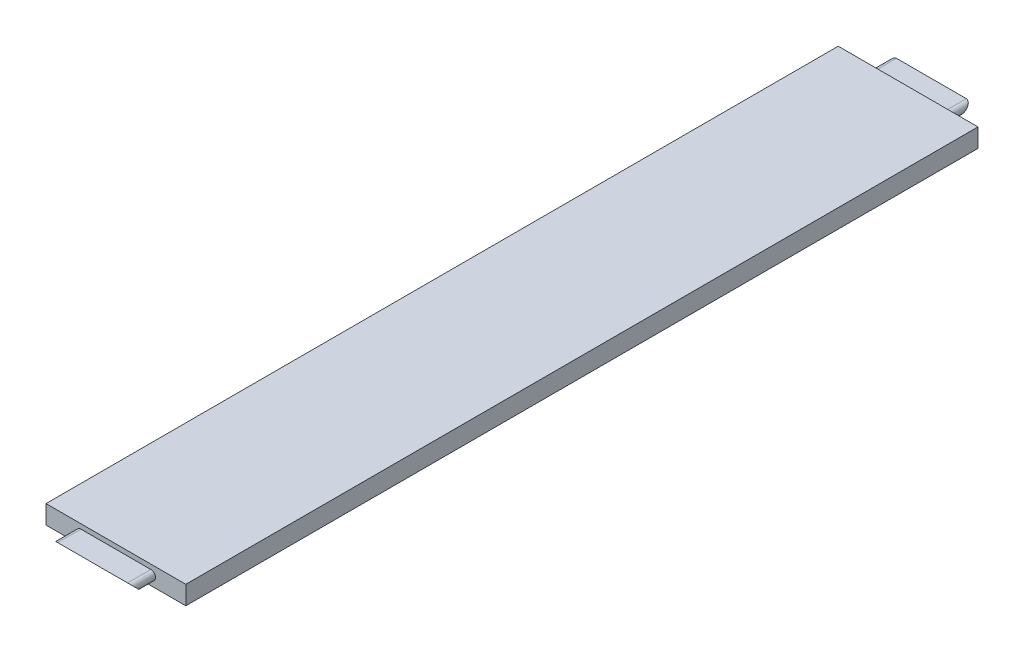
SolidWorks part; units mm, degrees
ref_plane "Alzado" through (0, 0, 0) normal (0, 0, 1) x (1, 0, 0)
ref_plane "Planta" through (0, 0, 0) normal (0, 1, 0) x (1, 0, 0)
ref_plane "Vista lateral" through (0, 0, 0) normal (1, 0, 0) x (0, 0, -1)
sketch "Croquis1" plane through (0, 0, 0) normal (0, 0, 1) x (1, 0, 0)
  line L0 (85, 12.5) -> (-85, -12.5) construction
  line L1 (-85, 12.5) -> (85, 12.5)
  line L2 (-85, 12.5) -> (-85, -12.5)
  line L3 (-85, -12.5) -> (85, -12.5)
  line L4 (85, 12.5) -> (85, -12.5)
extrude "Extruir1" add sketch "Croquis1" along normal mid plane 920
sketch "Croquis2" plane through (0, 0, 0) normal (0, 0, 1) x (1, 0, 0)
  line L0 (85, -12.5) -> (85, 12.5) construction
  line L1 (-85, 12.5) -> (85, 12.5)
  line L2 (-85, 12.5) -> (-85, 10)
  line L3 (-75, 10) -> (75, 10)
  line L4 (85, 12.5) -> (85, 10)
  line L5 (-85, 12.5) -> (-85, -12.5) construction
  line L6 (85, -12.5) -> (-85, -12.5)
  line L7 (85, -12.5) -> (85, -10)
  line L8 (75, -10) -> (-75, -10)
  line L9 (-85, -12.5) -> (-85, -10)
  line L10 (0, 0) -> (-85.2733, 0) construction
  line L11 (0, 0) -> (0, 19.2981) construction
  line L13 (-85, 10) -> (-85, -10)
  line L15 (-75, 10) -> (-75, -10)
  line L16 (75, 10) -> (75, -10)
  line L18 (85, 10) -> (85, -10)
  dimension "D1" = 20
  dimension "D2" = 150
extrude "Cepillado -Regruesado" cut sketch "Croquis2" against normal through all and the other way through all
sketch "Croquis3" plane through (0, 10, 0) normal (0, 1, 0) x (1, 0, 0)
  line L0 (75, 460) -> (-75, 460) construction
  line L1 (-75, 460) -> (75, 460)
  line L2 (-75, 460) -> (-75, 450)
  line L3 (-75, 450) -> (75, 450)
  line L4 (75, 460) -> (75, 450)
  line L5 (-75, 460) -> (-75, -460) construction
  line L6 (75, 460) -> (75, -460) construction
  line L7 (0, 0) -> (299.0225, 0) construction
  line L8 (75, -460) -> (-75, -460)
  line L9 (75, -460) -> (75, -450)
  line L10 (75, -450) -> (-75, -450)
  line L11 (-75, -460) -> (-75, -450)
  dimension "D1" = 10
extrude "Largo - Corte" cut sketch "Croquis3" against normal through all
sketch "Croquis4" plane through (0, 0, 450) normal (0, 0, 1) x (1, 0, 0)
  line L0 (-37.5, 0) -> (37.5, 0) construction
  line L1 (-37.5, 5) -> (37.5, 5)
  line L2 (-37.5, -5) -> (37.5, -5)
  line L7 (75, 10) -> (-75, 10)
  line L8 (-75, 10) -> (-75, -10)
  line L9 (-75, -10) -> (75, -10)
  line L10 (75, -10) -> (75, 10)
  line L11 (75, 10) -> (-75, 10)
  line L12 (-75, 10) -> (-75, -10)
  line L13 (-75, -10) -> (75, -10)
  line L14 (75, -10) -> (75, 10)
  arc A0 (-37.5, 5) -> (-37.5, -5) centre (-37.5, 0) ccw
  arc A1 (37.5, -5) -> (37.5, 5) centre (37.5, 0) ccw
  point P3 (0, 0)
  dimension "D2" = 5
  dimension "D1" = 75
  dimension "D3" = 0
extrude "Cortar-Extruir3" cut sketch "Croquis4" against normal blind 25
sketch "Croquis5" plane through (0, 0, 0) normal (1, 0, 0) x (0, 0, -1)
  line L0 (-450, 5) -> (-440, -5)
  line L1 (-425, -5) -> (-450, -5) construction
  line L2 (-440, -5) -> (-450, -5)
  line L3 (-450, 5) -> (-450, -5) construction
  line L4 (-450, -5) -> (-450, 5)
extrude "Cortar-Extruir4" cut sketch "Croquis5" against normal through all and the other way through all
mirror "Simetría1" about plane through (0, 0, 0) normal (0, 0, 1) of "Cortar-Extruir4", "Cortar-Extruir3"
